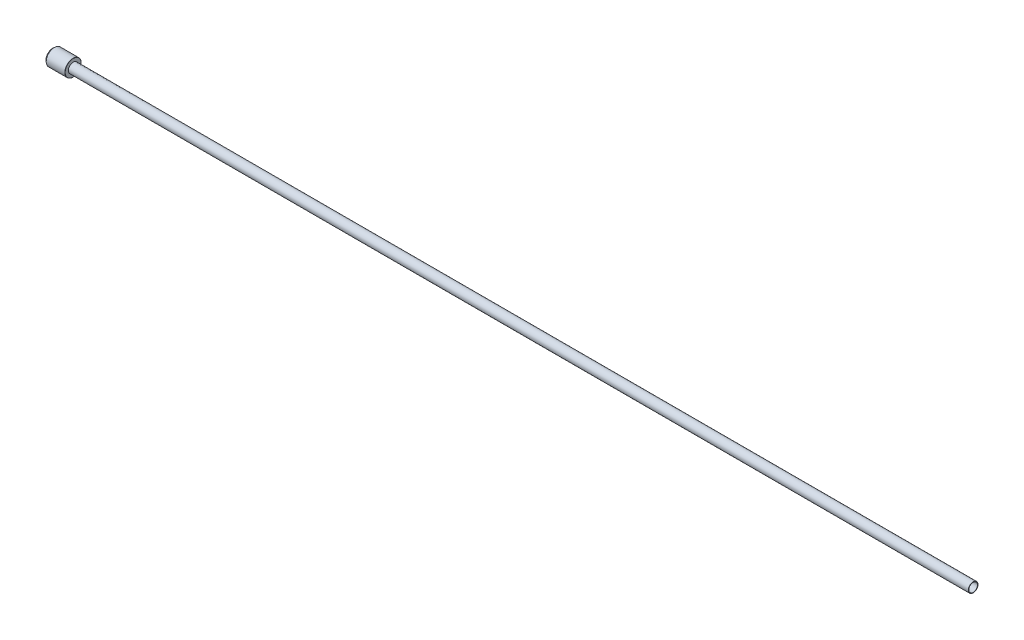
SolidWorks part; units mm, degrees
ref_plane "Front Plane" through (0, 0, 0) normal (0, 0, 1) x (1, 0, 0)
ref_plane "Top Plane" through (0, 0, 0) normal (0, 1, 0) x (1, 0, 0)
ref_plane "Right Plane" through (0, 0, 0) normal (1, 0, 0) x (0, 0, -1)
sketch "Sketch1" plane through (0, 0, 0) normal (0, 0, 1) x (1, 0, 0)
  line L0 (0.8045, 4) -> (8, 4)
  line L1 (10, 2.3749) -> (450, 2.3749)
  line L2 (8, 4) -> (10, 4)
  line L4 (10, 4) -> (10, 2.3749)
  line L5 (450, 2.3749) -> (450, 2.1209)
  line L7 (450, 2.1209) -> (0, 2.1209)
  line L8 (0, 2.1209) -> (0, 3.2955)
  line L9 (-22.2122, 0) -> (63.2184, 0) construction
  line L10 (0, 3.2955) -> (0.1, 3.2955)
  line L12 (0.1, 3.2955) -> (0.8045, 4)
  dimension "D2" = 8
  dimension "Thread" = 8
  dimension "D3" = 10
  dimension "tube ID" = 4.2418
  dimension "D4" = 4.7498
  dimension "D5" = 450
  dimension "minor diameter" = 6.591
  dimension "D9" = 45
  dimension "D10" = 0.1
revolve "Revolve1" add sketch "Sketch1" angle 360 about L9
fillet "Fillet2" radius 0.1 1 edges at (10, 0, 4)
